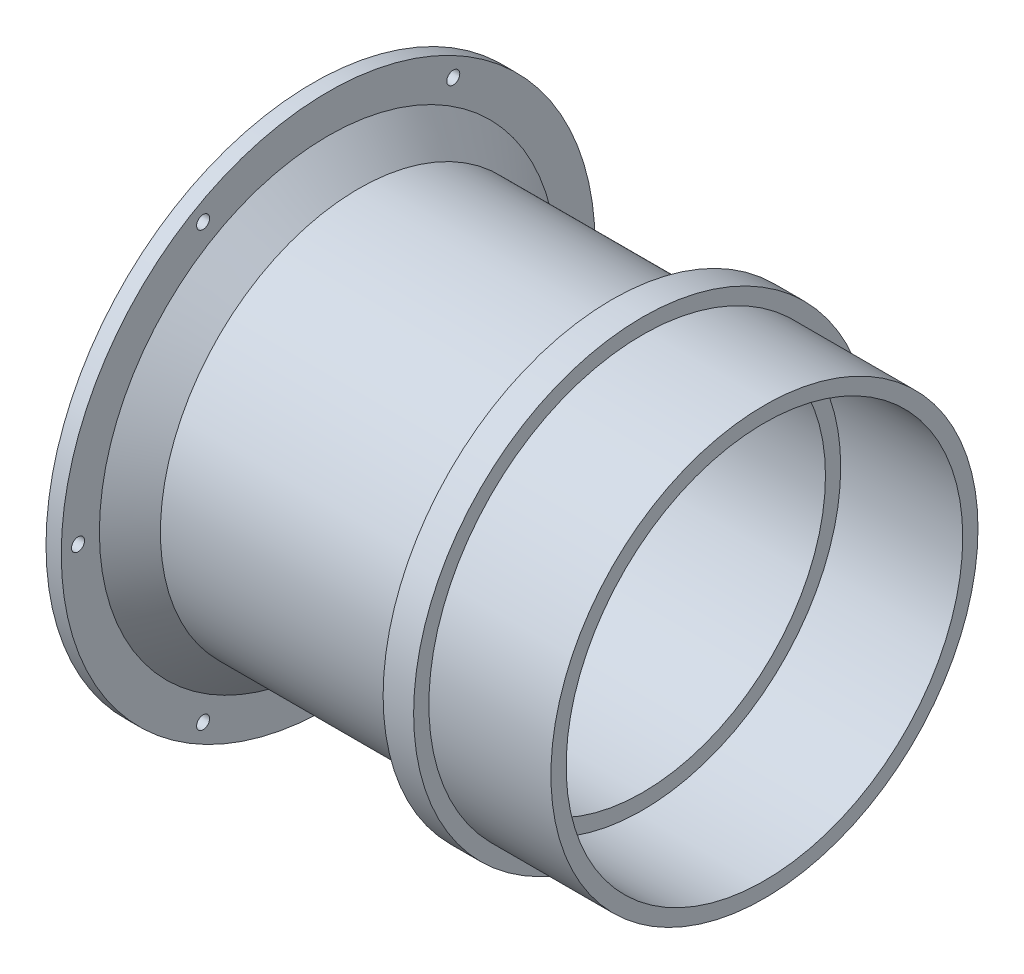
SolidWorks part; units mm, degrees
ref_plane "Front Plane" through (0, 0, 0) normal (0, 0, 1) x (1, 0, 0)
ref_plane "Top Plane" through (0, 0, 0) normal (0, 1, 0) x (1, 0, 0)
ref_plane "Right Plane" through (0, 0, 0) normal (1, 0, 0) x (0, 0, -1)
sketch "Sketch1" plane through (0, 0, 0) normal (0, 0, 1) x (1, 0, 0)
  line L0 (0, 6.35) -> (61.8249, 6.35) construction
  line L1 (0, 48.26) -> (0, 44.45)
  line L2 (0, 44.45) -> (6.35, 44.45)
  line L3 (6.35, 44.45) -> (6.35, 42.926)
  line L4 (7.1755, 38.1) -> (73.3552, 38.1)
  line L5 (73.3552, 44.45) -> (73.3552, 47.625)
  line L6 (67.0052, 42.8625) -> (65.4177, 41.275)
  line L7 (0, 48.26) -> (4.7752, 48.26)
  line L8 (4.7752, 48.26) -> (4.7752, 55.5625)
  line L9 (6.35, 42.926) -> (7.1755, 42.926)
  line L10 (7.1755, 42.926) -> (7.1755, 38.1)
  line L11 (7.9502, 47.625) -> (14.3002, 41.275)
  line L12 (14.3002, 41.275) -> (65.4177, 41.275)
  line L13 (4.7752, 55.5625) -> (7.9502, 55.5625)
  line L14 (7.9502, 55.5625) -> (7.9502, 47.625)
  line L16 (0, 0) -> (-23.3271, 0) construction
  line L17 (73.3552, 38.1) -> (73.3552, 41.275)
  line L18 (73.3552, 41.275) -> (98.7552, 41.275)
  line L19 (67.0052, 42.8625) -> (67.0052, 47.625)
  line L20 (67.0052, 47.625) -> (73.3552, 47.625)
  line L22 (73.3552, 44.45) -> (98.7552, 44.45)
  line L23 (98.7552, 44.45) -> (98.7552, 41.275)
  dimension "D19" = 6.35
  dimension "D1" = 76.2
  dimension "D3" = 63.5
  dimension "D4" = 6.35
  dimension "D5" = 1.524
  dimension "D6" = 69.85
  dimension "D7" = 83.82
  dimension "D8" = 4.7752
  dimension "D9" = 82.55
  dimension "D10" = 45
  dimension "D11" = 45
  dimension "D12" = 68.58
  dimension "D13" = 98.425
  dimension "D14" = 3.175
  dimension "D15" = 1.5875
  dimension "D16" = 69.85
  dimension "D17" = 0.8255
  dimension "D18" = 82.55
  dimension "D23" = 76.2
  dimension "D24" = 6.35
  dimension "D25" = 25.4
revolve "Revolve1" add sketch "Sketch1" angle 360 about L16
ref_plane "Plane1" through (0, 41.275, 0) normal (0, 1, 0) x (1, 0, 0)
sketch "Sketch2" plane through (0, 41.275, 0) normal (0, 1, 0) x (1, 0, 0)
  line L0 (75.565, 0) -> (12.7, 0) construction
  line L1 (75.565, -3.175) -> (12.7, -3.175)
  line L2 (75.565, 3.175) -> (12.7, 3.175)
  line L3 (9.525, 0) -> (9.525, -27.5657) construction
  line L5 (0, 44.45) -> (0, -44.45) construction
  line L6 (78.74, 0) -> (78.74, 37.6776) construction
  line L7 (0, 48.26) -> (0, -48.26) construction
  arc A0 (75.565, -3.175) -> (75.565, 3.175) centre (75.565, 0) ccw
  arc A1 (12.7, 3.175) -> (12.7, -3.175) centre (12.7, 0) ccw
  point P3 (44.1325, 0)
  dimension "D1" = 6.35
  dimension "D2" = 9.525
  dimension "D3" = 78.74
extrude "Cut-Extrude1" [suppressed] cut sketch "Sketch2" against normal blind 3.175 and the other way through all
hole_wizard "#6-32 Tapped Hole1" positions "Sketch4" profile "Sketch3" tap size "#6-32" standard "ANSI Inch"
sketch "Sketch4" plane through (4.7752, 0, 0) normal (-1, 0, 0) x (0, 0, 1)
  line L0 (-52.07, 0) -> (0, 0) construction
  point P0 (-52.07, 0)
  dimension "D1" = 52.07
sketch "Sketch3" plane through (4.7752, 0, -52.07) normal (0, 1, 0) x (0, 0, 1)
  line L0 (0, 0) -> (0, 11.176)
  line L1 (0, 11.176) -> (1.3525, 11.176)
  line L2 (1.3525, 11.176) -> (1.3525, 0)
  line L5 (1.3525, 0) -> (0, 0)
  line L10 (0, 11.176) -> (-1.3526, 11.176) construction
  line L11 (0, -6.35) -> (0, 107.95) construction
  dimension "Tap Drill Dia." = 2.7051
  dimension "Tap Drill Depth" = 11.176
  dimension "Drill Angle" = 180
hole_wizard "#6-32 Tapped Hole2" positions "Sketch8" profile "Sketch7" tap size "#6-32" standard "ANSI Inch"
sketch "Sketch8" plane through (86.0552, 0, 0) normal (1, 0, 0) x (0, 0, -1)
  line L0 (36.83, 0) -> (0, 0) construction
  point P0 (36.83, 0)
  dimension "D1" = 36.83
sketch "Sketch7" plane through (86.0552, 0, -36.83) normal (0, 1, 0) x (0, 0, -1)
  line L0 (0, 0) -> (0, 11.176)
  line L1 (0, 11.176) -> (1.3525, 11.176)
  line L2 (1.3525, 11.176) -> (1.3525, 0)
  line L5 (1.3525, 0) -> (0, 0)
  line L10 (0, 11.176) -> (-1.3526, 11.176) construction
  line L11 (0, -6.35) -> (0, 107.95) construction
  dimension "Tap Drill Dia." = 2.7051
  dimension "Tap Drill Depth" = 11.176
  dimension "Drill Angle" = 180
sketch "Sketch15" plane through (98.7552, 0, 0) normal (1, 0, 0) x (0, 0, -1)
  line L0 (0, 36.83) -> (0, 0) construction
  circle A0 centre (0, 36.83) radius 3.175
  dimension "D2" = 6.35
  dimension "D1" = 36.83
extrude "Cut-Extrude2" [suppressed] cut sketch "Sketch15" against normal blind 25.4
pattern_circular "CirPattern1" count 6 over 360 about axis through (0, 0, 0) along (1, 0, 0) of "#6-32 Tapped Hole1"
pattern_circular "CirPattern2" [suppressed] count 60 over 360
fillet "Fillet1" radius 0.508 1 edges at (0, 0, -48.26)
